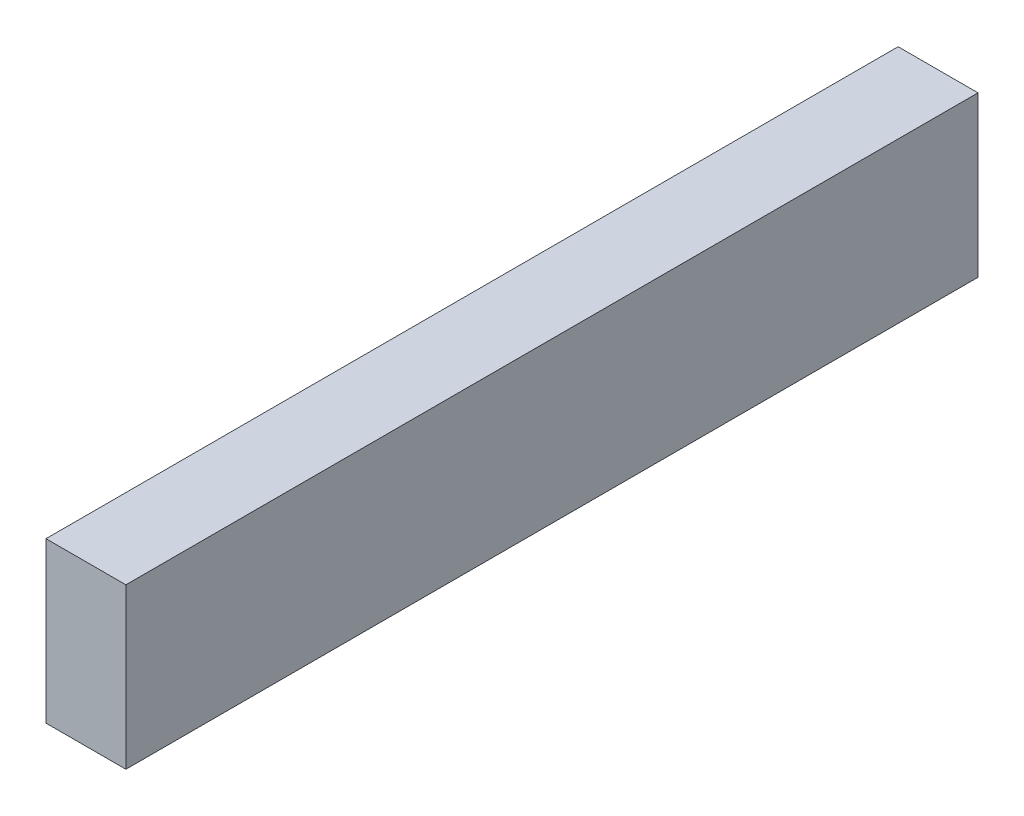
SolidWorks part; units mm, degrees
ref_plane "Plan de face" through (0, 0, 0) normal (0, 0, 1) x (1, 0, 0)
ref_plane "Plan de dessus" through (0, 0, 0) normal (0, 1, 0) x (1, 0, 0)
ref_plane "Plan de droite" through (0, 0, 0) normal (1, 0, 0) x (0, 0, -1)
sketch "Esquisse1" plane through (0, 0, 0) normal (0, 0, 1) x (1, 0, 0)
  line L1 (0, 0) -> (15, 0)
  line L2 (0, 0) -> (0, 30)
  line L3 (0, 30) -> (15, 30)
  line L4 (15, 0) -> (15, 30)
  dimension "D1" = 30
  dimension "D2" = 15
extrude "Extrusion1" add sketch "Esquisse1" along normal blind 160
